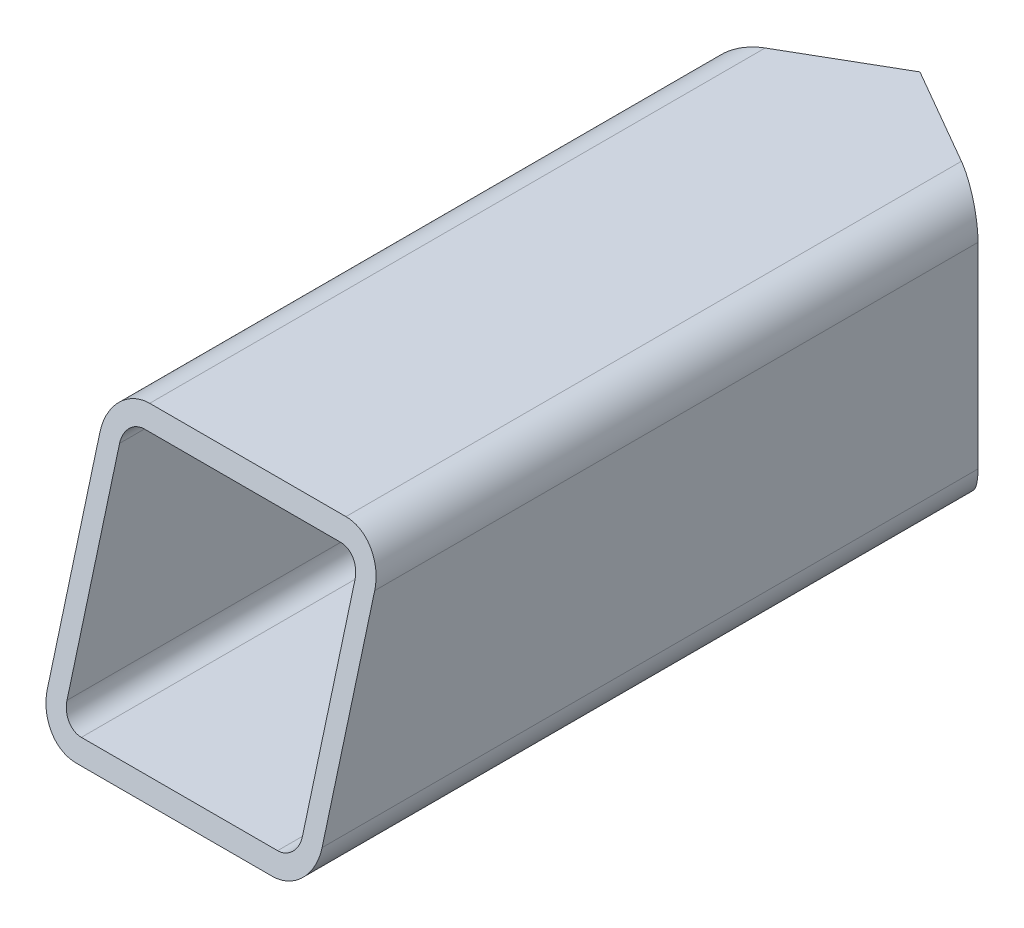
SolidWorks part; units mm, degrees
ref_plane "Plan de face" through (0, 0, 0) normal (0, 0, 1) x (1, 0, 0)
ref_plane "Plan de dessus" through (0, 0, 0) normal (0, 1, 0) x (1, 0, 0)
ref_plane "Plan de droite" through (0, 0, 0) normal (1, 0, 0) x (0, 0, -1)
sketch "Esquisse1" plane through (0, 0, 0) normal (0, 0, 1) x (1, 0, 0)
  line L0 (-30, 25) -> (-30, -25)
  line L1 (-25, 35) -> (25, 35)
  line L2 (-35, 25) -> (-35, -25)
  line L3 (-25, -35) -> (25, -35)
  line L4 (35, 25) -> (35, -25)
  line L5 (-25, -30) -> (25, -30)
  line L6 (30, 25) -> (30, -25)
  line L7 (-25, 30) -> (25, 30)
  line L8 (0, 43.669) -> (0, -45.4403) construction
  arc A0 (-25, 35) -> (-35, 25) centre (-25, 25) ccw
  arc A1 (25, 35) -> (35, 25) centre (25, 25) cw
  arc A2 (-25, -35) -> (-35, -25) centre (-25, -25) cw
  arc A3 (25, -35) -> (35, -25) centre (25, -25) ccw
  arc A4 (-25, 30) -> (-30, 25) centre (-25, 25) ccw
  arc A5 (-25, -30) -> (-30, -25) centre (-25, -25) cw
  arc A6 (25, -30) -> (30, -25) centre (25, -25) ccw
  arc A7 (25, 30) -> (30, 25) centre (25, 25) cw
  point P4 (0, -35)
  point P6 (-35, 0)
  point P11 (35, 35)
  point P14 (-35, -35)
  point P17 (35, -35)
  dimension "D3" = 10
  dimension "D4" = 10
  dimension "D5" = 10
  dimension "D1" = 70
  dimension "D2" = 70
  dimension "D6" = 5
extrude "Boss.-Extru.1" add sketch "Esquisse1" along normal blind 250
sketch "Esquisse2" plane through (0, 0, 0) normal (0, 0, 1) x (1, 0, 0)
  line L0 (0, 38.5337) -> (0, -40.1628) construction
sketch "Esquisse3" plane through (0, 35, 0) normal (0, 1, 0) x (1, 0, 0)
  line L0 (0, 0) -> (-35, -20.2073)
  line L1 (0, 0) -> (35, -20.2073)
  line L2 (25, 0) -> (-25, 0) construction
  line L4 (35, -250) -> (35, 0) construction
  line L5 (35, 0) -> (25, 0) construction
  line L6 (-35, 0) -> (-35, -20.2073)
  line L7 (35, 0) -> (35, -20.2073)
  line L8 (-35, -250) -> (-35, 0) construction
  dimension "D1" = 120
  dimension "D2" = 30
extrude "Enlèv. mat.-Extru.1" cut sketch "Esquisse3" against normal through all and the other way through all
sketch "Esquisse4" plane through (-35, 0, 0) normal (-1, 0, 0) x (0, 0, 1)
  line L0 (0, 35) -> (0, 30) construction
  line L2 (250, 62.4226) -> (250, -258.923)
  line L3 (250, -258.923) -> (159.7775, 77.792)
  line L4 (250, 25) -> (250, -25) construction
  line L5 (250, -35) -> (14.4338, -35) construction
  point P9 (190, -35)
  dimension "D1" = 190
  dimension "D2" = 15
extrude "Enlèv. mat.-Extru.3" cut sketch "Esquisse4" against normal through all and the other way through all flip side to cut
